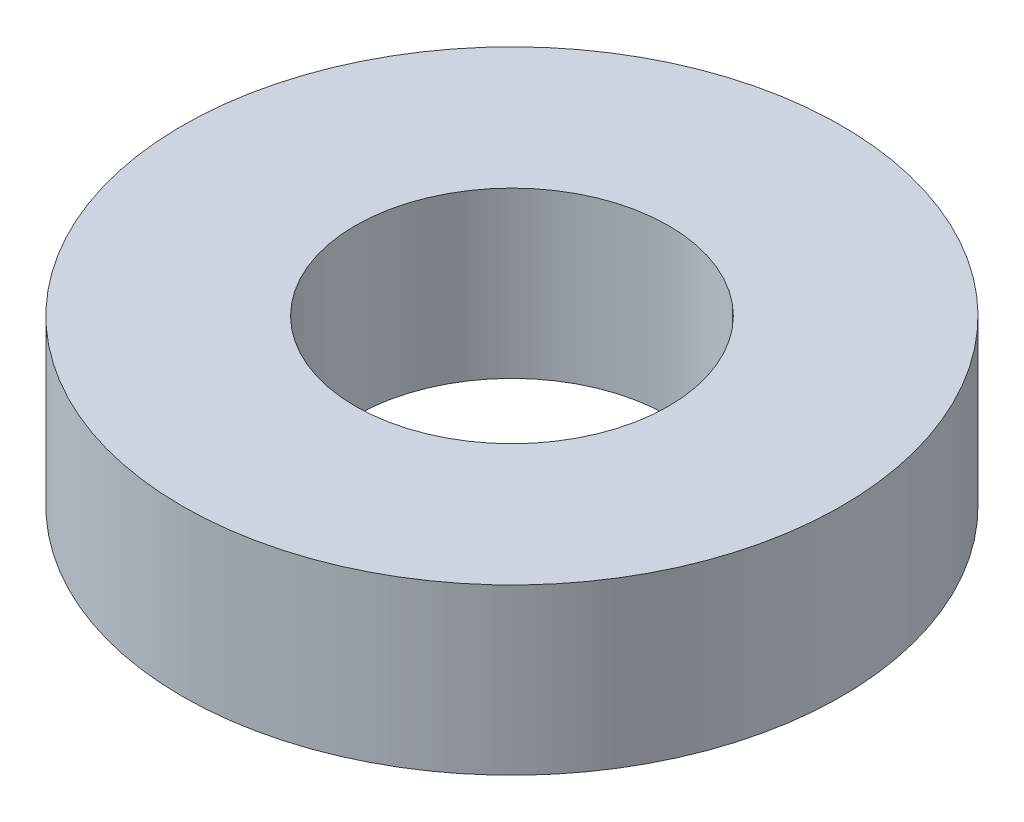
SolidWorks part; units mm, degrees
ref_plane "Ebene vorne" through (0, 0, 0) normal (0, 0, 1) x (1, 0, 0)
ref_plane "Ebene oben" through (0, 0, 0) normal (0, 1, 0) x (1, 0, 0)
ref_plane "Ebene rechts" through (0, 0, 0) normal (1, 0, 0) x (0, 0, -1)
sketch "Skizze1" plane through (0, 0, 0) normal (0, 1, 0) x (1, 0, 0)
  circle A0 centre (0, 0) radius 2
  circle A1 centre (0, 0) radius 0.95
  dimension "D1" = 1.9
  dimension "D2" = 4
extrude "Aufsatz-Linear austragen1" add sketch "Skizze1" along normal mid plane 1
